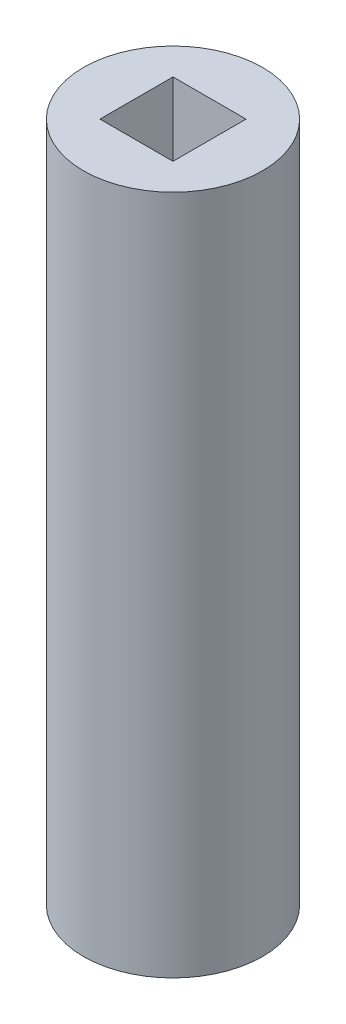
SolidWorks part; units mm, degrees
ref_plane "Спереди" through (0, 0, 0) normal (0, 0, 1) x (1, 0, 0)
ref_plane "Сверху" through (0, 0, 0) normal (0, 1, 0) x (1, 0, 0)
ref_plane "Справа" through (0, 0, 0) normal (1, 0, 0) x (0, 0, -1)
sketch "Эскиз1" plane through (0, 0, 0) normal (0, 1, 0) x (1, 0, 0)
  line L1 (5.1, -5.1) -> (-5.1, -5.1)
  line L2 (5.1, -5.1) -> (5.1, 5.1)
  line L3 (5.1, 5.1) -> (-5.1, 5.1)
  line L4 (-5.1, -5.1) -> (-5.1, 5.1)
  line L5 (5.1, -5.1) -> (-5.1, 5.1) construction
  line L6 (5.1, 5.1) -> (-5.1, -5.1) construction
  circle A0 centre (0, 0) radius 12.5
  dimension "D1" = 25
  dimension "D2" = 10.2
  dimension "D3" = 10.2
extrude "Бобышка-Вытянуть1" add sketch "Эскиз1" along normal blind 95
